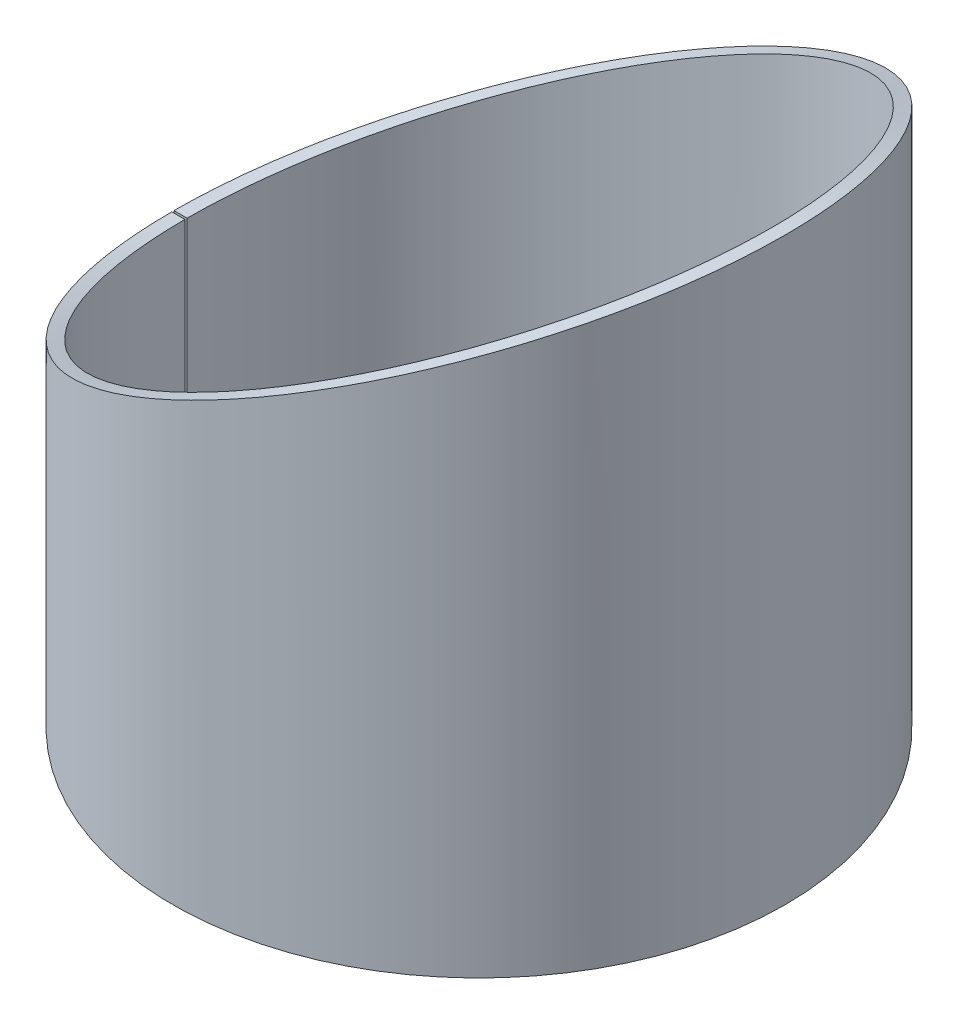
SolidWorks part; units mm, degrees
ref_plane "前视基准面" through (0, 0, 0) normal (0, 0, 1) x (1, 0, 0)
ref_plane "上视基准面" through (0, 0, 0) normal (0, 1, 0) x (1, 0, 0)
ref_plane "右视基准面" through (0, 0, 0) normal (1, 0, 0) x (0, 0, -1)
imported_body "基体零件-等径裤形管-1"
sheet metal parameters "钣金1" parameters "D1"=0.7366, "厚度"=6
bend "圆角折弯1" bend radius 134 bend angle 359.591 parameters "D5"=1
flatten bends "展开-折弯1"
sketch "尖角-草图1" plane through (160.0009, -384.3712, 0.5) normal (-1, 0, 0.0036) x (0.0036, 0, 1)
  line L0 (420.4948, 67.3587) -> (420.4948, -67.3587) construction
  dimension "D1" = 0
process bends "加工-折弯1" parameters "D1"=0
sketch "平面-草图1" plane through (160.0009, -384.3712, 0.5) normal (-1, 0, 0.0036) x (0.0036, 0, 1)
